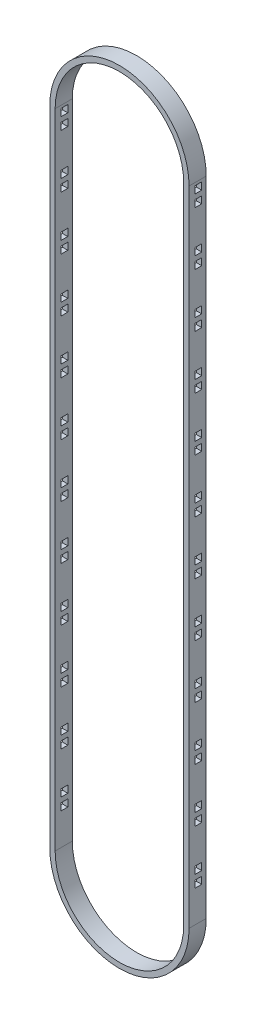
SolidWorks part; units mm, degrees
ref_plane "Plan de face" through (0, 0, 0) normal (0, 0, 1) x (1, 0, 0)
ref_plane "Plan de dessus" through (0, 0, 0) normal (0, 1, 0) x (1, 0, 0)
ref_plane "Plan de droite" through (0, 0, 0) normal (1, 0, 0) x (0, 0, -1)
sketch "Esquisse1" plane through (0, 0, 0) normal (0, 0, 1) x (1, 0, 0)
  line L0 (60, 0) -> (60, -600)
  line L1 (-60, 0) -> (-60, -600)
  line L2 (65, 0) -> (65, -600)
  line L3 (-65, 0) -> (-65, -600)
  arc A0 (60, 0) -> (-60, 0) centre (0, 0) ccw
  arc A1 (-60, -600) -> (60, -600) centre (0, -600) ccw
  arc A2 (-65, -600) -> (65, -600) centre (0, -600) ccw
  arc A3 (65, 0) -> (-65, 0) centre (0, 0) ccw
  dimension "D2" = 120
  dimension "D3" = 120
  dimension "D1" = 600
  dimension "D4" = 5
extrude "Extrusion1" add sketch "Esquisse1" along normal blind 16
sketch "Esquisse2" plane through (65, 0, 0) normal (1, 0, 0) x (0, 0, -1)
  line L0 (-10.5175, -52.522) -> (-10.5175, -59.2399)
  line L1 (-10.5175, -2.522) -> (-4.1947, -2.522)
  line L2 (-10.5175, -2.522) -> (-10.5175, -9.2399)
  line L3 (-10.5175, -9.2399) -> (-4.1947, -9.2399)
  line L4 (-4.1947, -2.522) -> (-4.1947, -9.2399)
  line L5 (-10.5175, -52.522) -> (-4.1947, -52.522)
  line L6 (-4.1947, -52.522) -> (-4.1947, -59.2399)
  line L7 (-10.5175, -59.2399) -> (-4.1947, -59.2399)
  line L8 (-10.5175, -102.522) -> (-10.5175, -109.2399)
  line L9 (-10.5175, -102.522) -> (-4.1947, -102.522)
  line L10 (-4.1947, -102.522) -> (-4.1947, -109.2399)
  line L11 (-10.5175, -109.2399) -> (-4.1947, -109.2399)
  line L12 (-10.5175, -152.522) -> (-10.5175, -159.2399)
  line L13 (-10.5175, -152.522) -> (-4.1947, -152.522)
  line L14 (-4.1947, -152.522) -> (-4.1947, -159.2399)
  line L15 (-10.5175, -159.2399) -> (-4.1947, -159.2399)
  line L16 (-10.5175, -202.522) -> (-10.5175, -209.2399)
  line L17 (-10.5175, -202.522) -> (-4.1947, -202.522)
  line L18 (-4.1947, -202.522) -> (-4.1947, -209.2399)
  line L19 (-10.5175, -209.2399) -> (-4.1947, -209.2399)
  line L20 (-10.5175, -252.522) -> (-10.5175, -259.2399)
  line L21 (-10.5175, -252.522) -> (-4.1947, -252.522)
  line L22 (-4.1947, -252.522) -> (-4.1947, -259.2399)
  line L23 (-10.5175, -259.2399) -> (-4.1947, -259.2399)
  line L24 (-10.5175, -302.522) -> (-10.5175, -309.2399)
  line L25 (-10.5175, -302.522) -> (-4.1947, -302.522)
  line L26 (-4.1947, -302.522) -> (-4.1947, -309.2399)
  line L27 (-10.5175, -309.2399) -> (-4.1947, -309.2399)
  line L28 (-10.5175, -352.522) -> (-10.5175, -359.2399)
  line L29 (-10.5175, -352.522) -> (-4.1947, -352.522)
  line L30 (-4.1947, -352.522) -> (-4.1947, -359.2399)
  line L31 (-10.5175, -359.2399) -> (-4.1947, -359.2399)
  line L32 (-10.5175, -402.522) -> (-10.5175, -409.2399)
  line L33 (-10.5175, -402.522) -> (-4.1947, -402.522)
  line L34 (-4.1947, -402.522) -> (-4.1947, -409.2399)
  line L35 (-10.5175, -409.2399) -> (-4.1947, -409.2399)
  line L36 (-10.5175, -452.522) -> (-10.5175, -459.2399)
  line L37 (-10.5175, -452.522) -> (-4.1947, -452.522)
  line L38 (-4.1947, -452.522) -> (-4.1947, -459.2399)
  line L39 (-10.5175, -459.2399) -> (-4.1947, -459.2399)
  line L40 (-10.5175, -502.522) -> (-10.5175, -509.2399)
  line L41 (-10.5175, -502.522) -> (-4.1947, -502.522)
  line L42 (-4.1947, -502.522) -> (-4.1947, -509.2399)
  line L43 (-10.5175, -509.2399) -> (-4.1947, -509.2399)
  line L44 (-10.5175, -552.522) -> (-10.5175, -559.2399)
  line L45 (-10.5175, -552.522) -> (-4.1947, -552.522)
  line L46 (-4.1947, -552.522) -> (-4.1947, -559.2399)
  line L47 (-10.5175, -559.2399) -> (-4.1947, -559.2399)
  line L48 (-10.5175, -70.3547) -> (-4.1947, -70.3547)
  line L49 (-10.5175, -13.8012) -> (-4.1947, -13.8012)
  line L50 (-10.5175, -13.8012) -> (-10.5175, -20.3547)
  line L51 (-10.5175, -20.3547) -> (-4.1947, -20.3547)
  line L52 (-4.1947, -13.8012) -> (-4.1947, -20.3547)
  line L53 (-10.5175, -63.8012) -> (-4.1947, -63.8012)
  line L54 (-4.1947, -63.8012) -> (-4.1947, -70.3547)
  line L55 (-10.5175, -63.8012) -> (-10.5175, -70.3547)
  line L56 (-10.5175, -120.3547) -> (-4.1947, -120.3547)
  line L57 (-10.5175, -113.8012) -> (-4.1947, -113.8012)
  line L58 (-4.1947, -113.8012) -> (-4.1947, -120.3547)
  line L59 (-10.5175, -113.8012) -> (-10.5175, -120.3547)
  line L60 (-10.5175, -170.3547) -> (-4.1947, -170.3547)
  line L61 (-10.5175, -163.8012) -> (-4.1947, -163.8012)
  line L62 (-4.1947, -163.8012) -> (-4.1947, -170.3547)
  line L63 (-10.5175, -163.8012) -> (-10.5175, -170.3547)
  line L64 (-10.5175, -220.3547) -> (-4.1947, -220.3547)
  line L65 (-10.5175, -213.8012) -> (-4.1947, -213.8012)
  line L66 (-4.1947, -213.8012) -> (-4.1947, -220.3547)
  line L67 (-10.5175, -213.8012) -> (-10.5175, -220.3547)
  line L68 (-10.5175, -270.3547) -> (-4.1947, -270.3547)
  line L69 (-10.5175, -263.8012) -> (-4.1947, -263.8012)
  line L70 (-4.1947, -263.8012) -> (-4.1947, -270.3547)
  line L71 (-10.5175, -263.8012) -> (-10.5175, -270.3547)
  line L72 (-10.5175, -320.3547) -> (-4.1947, -320.3547)
  line L73 (-10.5175, -313.8012) -> (-4.1947, -313.8012)
  line L74 (-4.1947, -313.8012) -> (-4.1947, -320.3547)
  line L75 (-10.5175, -313.8012) -> (-10.5175, -320.3547)
  line L76 (-10.5175, -370.3547) -> (-4.1947, -370.3547)
  line L77 (-10.5175, -363.8012) -> (-4.1947, -363.8012)
  line L78 (-4.1947, -363.8012) -> (-4.1947, -370.3547)
  line L79 (-10.5175, -363.8012) -> (-10.5175, -370.3547)
  line L80 (-10.5175, -420.3547) -> (-4.1947, -420.3547)
  line L81 (-10.5175, -413.8012) -> (-4.1947, -413.8012)
  line L82 (-4.1947, -413.8012) -> (-4.1947, -420.3547)
  line L83 (-10.5175, -413.8012) -> (-10.5175, -420.3547)
  line L84 (-10.5175, -470.3547) -> (-4.1947, -470.3547)
  line L85 (-10.5175, -463.8012) -> (-4.1947, -463.8012)
  line L86 (-4.1947, -463.8012) -> (-4.1947, -470.3547)
  line L87 (-10.5175, -463.8012) -> (-10.5175, -470.3547)
  line L88 (-10.5175, -520.3547) -> (-4.1947, -520.3547)
  line L89 (-10.5175, -513.8012) -> (-4.1947, -513.8012)
  line L90 (-4.1947, -513.8012) -> (-4.1947, -520.3547)
  line L91 (-10.5175, -513.8012) -> (-10.5175, -520.3547)
  line L92 (-10.5175, -570.3547) -> (-4.1947, -570.3547)
  line L93 (-10.5175, -563.8012) -> (-4.1947, -563.8012)
  line L94 (-4.1947, -563.8012) -> (-4.1947, -570.3547)
  line L95 (-10.5175, -563.8012) -> (-10.5175, -570.3547)
extrude "Enlèv. mat.-Extru.1" cut sketch "Esquisse2" against normal blind 188
